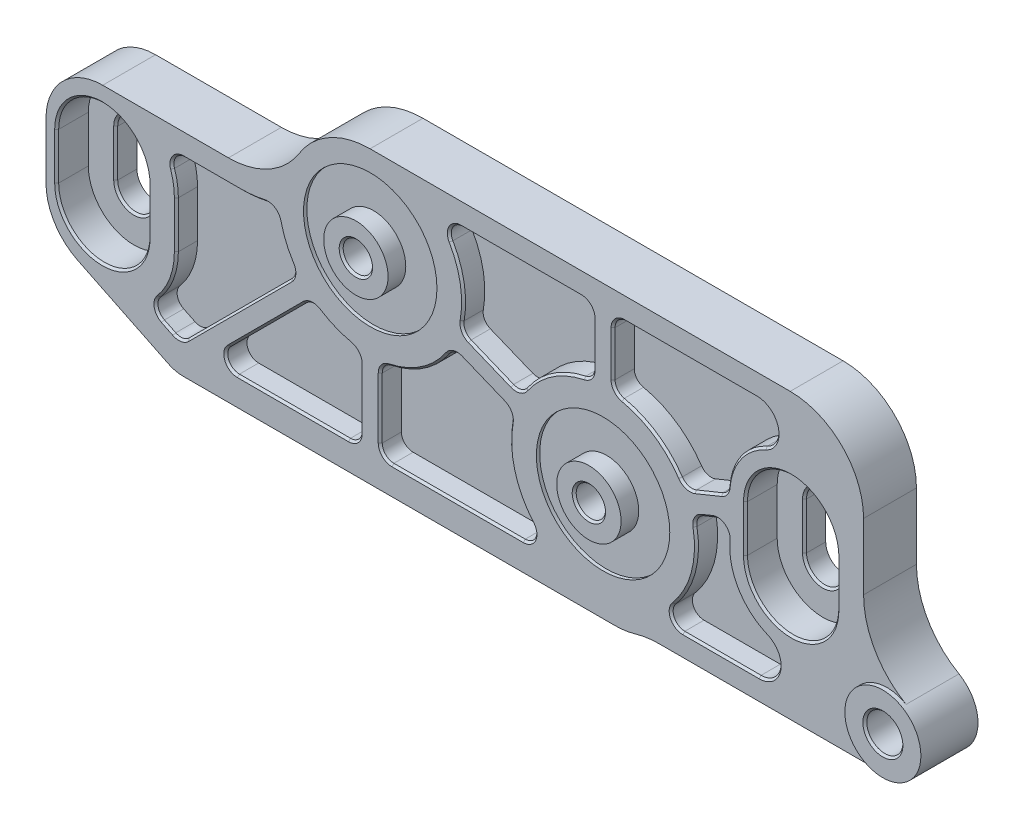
SolidWorks part; units mm, degrees
ref_plane "Front Plane" through (0, 0, 0) normal (0, 0, 1) x (1, 0, 0)
ref_plane "Top Plane" through (0, 0, 0) normal (0, 1, 0) x (1, 0, 0)
ref_plane "Right Plane" through (0, 0, 0) normal (1, 0, 0) x (0, 0, -1)
sketch "Sketch1" plane through (0, 0, 0) normal (0, 0, 1) x (1, 0, 0)
  line L0 (252.15, 1.9) -> (183.8059, 1.9)
  line L7 (0, 46.5) -> (0, 29.5501)
  line L8 (9.5477, 14.2706) -> (36.8355, 0.9615)
  line L9 (41, 0) -> (170.5059, 0)
  line L11 (245.1, 45.2563) -> (245.1, 65.0804)
  line L12 (223.1, 87.0804) -> (97.15, 87.0804)
  line L13 (54.7, 63.5) -> (17, 63.5)
  line L22 (11.4, 45.025) -> (11.4, 31.025)
  line L23 (22.4, 31.025) -> (22.4, 45.025)
  line L26 (217.9, 51.4777) -> (217.9, 37.4777)
  line L27 (228.9, 37.4777) -> (228.9, 51.4777)
  arc A0 (245.1, 45.2563) -> (257.85, 23.1727) centre (270.6, 45.2563) ccw
  arc A1 (252.15, 1.9) -> (257.85, 23.1727) centre (252.15, 13.3) ccw
  arc A2 (183.8059, 1.9) -> (176.6659, 0.88) centre (183.8059, -23.6) ccw
  arc A8 (0, 29.5501) -> (9.5477, 14.2706) centre (17, 29.5501) ccw
  arc A9 (36.8355, 0.9615) -> (41, 0) centre (41, 9.5) ccw
  arc A10 (170.5059, 0) -> (176.6659, 0.88) centre (170.5059, 22) ccw
  arc A12 (245.1, 65.0804) -> (223.1, 87.0804) centre (223.1, 65.0804) ccw
  arc A13 (97.15, 87.0804) -> (75.925, 75.2902) centre (97.15, 62.0804) ccw
  arc A14 (54.7, 63.5) -> (75.925, 75.2902) centre (54.7, 88.5) ccw
  arc A15 (17, 63.5) -> (0, 46.5) centre (17, 46.5) ccw
  arc A28 (11.4, 31.025) -> (22.4, 31.025) centre (16.9, 31.025) ccw
  arc A29 (22.4, 45.025) -> (11.4, 45.025) centre (16.9, 45.025) ccw
  arc A32 (217.9, 37.4777) -> (228.9, 37.4777) centre (223.4, 37.4777) ccw
  arc A33 (228.9, 51.4777) -> (217.9, 51.4777) centre (223.4, 51.4777) ccw
  point P71 (0, 38.025)
  point P77 (11.4, 38.025)
  dimension "D1" = 25.5
  dimension "D2" = 22.8
  dimension "D3" = 25.5
  dimension "D4" = 252.15
  dimension "D5" = 22
  dimension "D6" = 17
  dimension "D7" = 154
  dimension "D8" = 9.5
  dimension "D9" = 63.5
  dimension "D10" = 25
  dimension "D11" = 41
  dimension "D12" = 245.1
  dimension "D13" = 22
  dimension "D14" = 54.7
  dimension "D15" = 97.15
  dimension "D16" = 1.9
  dimension "D17" = 5.5
  dimension "D18" = 14
  dimension "D19" = 16.9
  dimension "D20" = 5.5
  dimension "D21" = 37.4777
  dimension "D22" = 14
  dimension "D23" = 21.7
extrude "Extrude1" add sketch "Sketch1" against normal blind 15.85
sketch "Sketch2" plane through (0, 0, 0) normal (0, 0, 1) x (1, 0, 0)
  circle A2 centre (97.2, 60.9) radius 20
  circle A4 centre (167, 32.4) radius 20
  dimension "D1" = 40
  dimension "D2" = 40
  dimension "D3" = 167
  dimension "D4" = 97.2
  dimension "D5" = 60.9
  dimension "D6" = 32.4
extrude "Cut-Extrude1" cut sketch "Sketch2" against normal blind 1
sketch "Sketch3" plane through (0, 0, -1) normal (0, 0, 1) x (1, 0, 0)
  circle A1 centre (97.2, 60.9) radius 9.65
  circle A3 centre (167.05, 32.3) radius 9.65
  circle A4 centre (97.2, 60.9) radius 20 construction
  dimension "D1" = 19.3
  dimension "D2" = 19.3
  dimension "D3" = 69.85
  dimension "D4" = 28.6
extrude "Extrude2" add sketch "Sketch3" along normal blind 5.3
sketch "Sketch4" plane through (0, 0, 0) normal (0, 0, 1) x (1, 0, 0)
  line L4 (30.6, 30.9) -> (30.6, 44.85)
  line L5 (3.2, 44.85) -> (3.2, 30.9)
  line L11 (209.7, 51.45) -> (209.7, 37.5)
  line L12 (237.1, 37.5) -> (237.1, 51.45)
  arc A4 (3.2, 30.9) -> (30.6, 30.9) centre (16.9, 30.9) ccw
  arc A5 (30.6, 44.85) -> (3.2, 44.85) centre (16.9, 44.85) ccw
  arc A10 (209.7, 37.5) -> (237.1, 37.5) centre (223.4, 37.5) ccw
  arc A11 (237.1, 51.45) -> (209.7, 51.45) centre (223.4, 51.45) ccw
  dimension "D1" = 13.7
  dimension "D2" = 13.7
  dimension "D3" = 223.4
  dimension "D4" = 16.9
  dimension "D5" = 51.45
  dimension "D6" = 30.9
  dimension "D7" = 6.6
  dimension "D8" = 7.35
extrude "Cut-Extrude2" cut sketch "Sketch4" against normal blind 9.5
sketch "Sketch14" plane through (0, 0, 0) normal (0, 0, 1) x (1, 0, 0)
  circle A0 centre (252.15, 13.3) radius 11.4
  arc A1 (252.15, 1.9) -> (257.85, 23.1727) centre (252.15, 13.3) ccw construction
extrude "Extrude4" add sketch "Sketch14" along normal blind 1.27
hole_wizard "M12x1.25 Tapped Hole1" positions "Sketch8" profile "Sketch9" tap size "M12x1.25" standard "ISO"
sketch "Sketch8" plane through (-1.6354, 0.9401, 1.27) normal (0, 0, 1) x (1, 0, 0)
  circle A0 centre (253.7854, 12.3599) radius 11.4 construction
  point P0 (253.7854, 12.3599)
sketch "Sketch9" plane through (252.15, 13.3, 1.27) normal (1, 0, 0) x (0, -1, 0)
  line L0 (0, 0) -> (0, 17.12)
  line L1 (0, 17.12) -> (5.4, 17.12)
  line L2 (5.4, 17.12) -> (5.4, 0)
  line L5 (5.4, 0) -> (0, 0)
  line L11 (0, -6.35) -> (0, 107.95) construction
  dimension "Thru Tap Drill Dia." = 10.8
  dimension "Thru Tap Drill Depth" = 17.12
hole_wizard "M10x1.25 Tapped Hole1" positions "Sketch12" profile "Sketch13" tap size "M10x1.25" standard "ISO"
sketch "Sketch12" plane through (0, 0, 4.3) normal (0, 0, 1) x (1, 0, 0)
  point P0 (97.2, 60.9)
  point P1 (167.05, 32.3)
sketch "Sketch13" plane through (97.2, 60.9, 4.3) normal (1, 0, 0) x (0, -1, 0)
  line L0 (0, 0) -> (0, 20.15)
  line L1 (0, 20.15) -> (4.4, 20.15)
  line L2 (4.4, 20.15) -> (4.4, 0)
  line L5 (4.4, 0) -> (0, 0)
  line L11 (0, -6.35) -> (0, 107.95) construction
  dimension "Thru Tap Drill Dia." = 8.8
  dimension "Thru Tap Drill Depth" = 20.15
sketch "Sketch5" plane through (0, 0, 0) normal (0, 0, 1) x (1, 0, 0)
  line L0 (167, 32.4) -> (97.2, 60.9) construction
  line L1 (167, 32.4) -> (167, 93.8498) construction
  line L2 (97.2, 60.9) -> (97.2, 5.1118) construction
  line L3 (41, 0) -> (170.5059, 0) construction
  line L4 (9.5477, 14.2706) -> (36.8355, 0.9615) construction
  line L5 (97.2, 60.9) -> (46.0418, 9.7418) construction
  line L6 (167, 32.4) -> (236.8, 60.9) construction
  line L7 (223.1, 87.0804) -> (97.15, 87.0804) construction
  line L8 (58.3491, 56.7) -> (41.2491, 56.7)
  line L9 (39.0848, 45.025) -> (39.0848, 31.025)
  line L10 (34.9295, 11.2369) -> (38.3081, 9.589)
  line L11 (42.3173, 10.26) -> (73.2842, 41.2268)
  line L12 (54.7, 63.5) -> (17, 63.5) construction
  line L14 (57.3924, 8.4) -> (90.7, 8.4)
  line L15 (94.2, 11.9) -> (94.2, 30.0779)
  line L16 (77.5268, 36.9842) -> (54.9175, 14.3749)
  line L20 (103.7, 8.4) -> (143.0835, 8.4)
  line L21 (137.3309, 41.2737) -> (124.601, 46.4715)
  line L22 (100.2, 30.0779) -> (100.2, 11.9)
  line L26 (164, 63.2221) -> (164, 76.7804)
  line L27 (160.5, 80.2804) -> (124.4041, 80.2804)
  line L28 (126.8691, 52.0263) -> (139.599, 46.8285)
  line L30 (213.1512, 80.2804) -> (173.5, 80.2804)
  line L31 (170, 76.7804) -> (170, 63.2221)
  line L33 (196.6691, 41.2737) -> (200.1032, 42.6759)
  line L35 (194.401, 46.8285) -> (202.2964, 50.0523)
  line L43 (190.9165, 8.4) -> (213.7865, 8.4)
  arc A0 (216.0937, 19.9386) -> (213.7865, 8.4) centre (213.7865, 14.4) cw
  arc A1 (190.1804, 48.1056) -> (172.7778, 59.7974) centre (167, 32.4) ccw
  arc A2 (200.1032, 42.6759) -> (204.4966, 39.3911) centre (201.3129, 39.7134) cw
  arc A3 (215.6109, 68.8077) -> (213.1512, 80.2804) centre (213.1512, 74.2804) ccw
  arc A4 (194.401, 46.8285) -> (190.1804, 48.1056) centre (193.078, 50.0688) cw
  circle A5 centre (167, 32.4) radius 20 construction
  circle A6 centre (97.2, 60.9) radius 4.4 construction
  arc A7 (228.9, 51.4777) -> (217.9, 51.4777) centre (223.4, 51.4777) ccw construction
  arc A9 (11.4, 31.025) -> (22.4, 31.025) centre (16.9, 31.025) ccw construction
  arc A10 (22.4, 45.025) -> (11.4, 45.025) centre (16.9, 45.025) ccw construction
  arc A11 (204.4966, 39.3911) -> (216.0937, 19.9386) centre (223.4, 37.4777) ccw
  arc A18 (69.8645, 54.836) -> (65.6975, 57.4966) centre (66.4476, 54.078) ccw
  arc A19 (58.3491, 56.7) -> (65.6975, 57.4966) centre (58.3491, 90.99) ccw
  arc A20 (41.2491, 56.7) -> (37.9311, 52.086) centre (41.2491, 53.2) ccw
  arc A21 (39.0848, 45.025) -> (37.9311, 52.086) centre (16.9, 45.025) ccw
  arc A22 (33.7979, 16.6505) -> (39.0848, 31.025) centre (16.9, 31.025) ccw
  arc A23 (33.7979, 16.6505) -> (34.9295, 11.2369) centre (36.4638, 14.3827) ccw
  arc A24 (38.3081, 9.589) -> (42.3173, 10.26) centre (39.8424, 12.7348) ccw
  arc A25 (73.2842, 41.2268) -> (73.7416, 45.6126) centre (70.8093, 43.7017) ccw
  arc A26 (69.8645, 54.836) -> (73.7416, 45.6126) centre (97.2, 60.9) ccw
  arc A28 (90.7, 8.4) -> (94.2, 11.9) centre (90.7, 11.9) ccw
  arc A29 (94.2, 30.0779) -> (91.4222, 33.5026) centre (90.7, 30.0779) ccw
  arc A30 (81.9126, 37.4416) -> (91.4222, 33.5026) centre (97.2, 60.9) ccw
  arc A31 (81.9126, 37.4416) -> (77.5268, 36.9842) centre (80.0017, 34.5093) ccw
  arc A32 (54.9175, 14.3749) -> (57.3924, 8.4) centre (57.3924, 11.9) ccw
  arc A42 (143.0835, 8.4) -> (145.7409, 14.1778) centre (143.0835, 11.9) ccw
  arc A43 (204.4619, 53.0103) -> (202.2964, 50.0523) centre (200.9733, 53.2926) cw
  arc A44 (139.4514, 37.4075) -> (137.3309, 41.2737) centre (136.0078, 38.0334) ccw
  arc A45 (124.601, 46.4715) -> (120.3804, 45.1944) centre (123.278, 43.2312) ccw
  arc A46 (102.9778, 33.5026) -> (120.3804, 45.1944) centre (97.2, 60.9) ccw
  arc A47 (102.9778, 33.5026) -> (100.2, 30.0779) centre (103.7, 30.0779) ccw
  arc A48 (100.2, 11.9) -> (103.7, 8.4) centre (103.7, 11.9) ccw
  arc A56 (164, 76.7804) -> (160.5, 80.2804) centre (160.5, 76.7804) ccw
  arc A57 (124.4041, 80.2804) -> (121.3814, 75.0159) centre (124.4041, 76.7804) ccw
  arc A58 (124.7486, 55.8925) -> (121.3814, 75.0159) centre (97.2, 60.9) ccw
  arc A59 (124.7486, 55.8925) -> (126.8691, 52.0263) centre (128.1922, 55.2666) ccw
  arc A60 (139.599, 46.8285) -> (143.8196, 48.1056) centre (140.922, 50.0688) ccw
  arc A61 (161.2222, 59.7974) -> (143.8196, 48.1056) centre (167, 32.4) ccw
  arc A62 (161.2222, 59.7974) -> (164, 63.2221) centre (160.5, 63.2221) ccw
  arc A64 (215.6109, 68.8077) -> (204.4619, 53.0103) centre (223.4, 51.4777) ccw
  arc A76 (196.6691, 41.2737) -> (194.5486, 37.4075) centre (197.9922, 38.0334) ccw
  arc A77 (188.2591, 14.1778) -> (194.5486, 37.4075) centre (167, 32.4) ccw
  arc A78 (190.9165, 8.4) -> (188.2591, 14.1778) centre (190.9165, 11.9) cw
  arc A80 (173.5, 80.2804) -> (170, 76.7804) centre (173.5, 76.7804) ccw
  arc A81 (170, 63.2221) -> (172.7778, 59.7974) centre (173.5, 63.2221) ccw
  arc A87 (139.4514, 37.4075) -> (145.7409, 14.1778) centre (167, 32.4) ccw
  point P114 (167.9667, 30.0341)
  point P115 (237.8167, 58.6091)
  point P116 (166.0433, 34.7359)
  point P117 (235.8933, 63.3109)
  dimension "D6" = 28
  dimension "D13" = 45
  dimension "D15" = 6.8
  dimension "D7" = 8.4
  dimension "D9" = 6
  dimension "D2" = 19
  dimension "D4" = 3.2
  dimension "D5" = 6.8
  dimension "D3" = 3.5
  dimension "D10" = 6
  dimension "D8" = 8.4
extrude "LW Pockets " cut sketch "Sketch5" against normal blind 6.35
chamfer "Chamfer3" distance 0.6 angle 45 78 edges at (202.3515, 8.4, 0) (187.7367, 10.4375, 0) (194.0269, 25.0825, 0) (194.9234, 39.7166, 0) (198.3862, 41.9748, 0) (192.0643, 46.7188, 0) (198.3487, 48.4404, 0) (182.6147, 55.6418, 0) (203.7974, 51.2251, 0) (170.7817, 61.0173, 0) (207.8766, 62.4333, 0) (170, 70.0012, 0) (171.0251, 79.2552, 0) (193.3256, 80.2804, 0) (133.234, 49.4274, 0) (141.9357, 46.7188, 0) (125.1234, 53.5834, 0) (151.3853, 55.6418, 0) (124.7758, 65.7554, 0) (163.2183, 61.0173, 0) (121.3689, 78.5231, 0) (164, 70.0012, 0) (142.4521, 80.2804, 0) (162.9749, 79.2552, 0) (123.3917, 8.4, 0) (146.2633, 10.4375, 0) (101.2251, 9.4251, 0) (139.9731, 25.0825, 0) (100.2, 20.989, 0) (139.0766, 39.7166, 0) (100.9817, 32.2827, 0) (130.966, 43.8726, 0) (112.8147, 37.6582, 0) (122.2643, 46.5812, 0) (93.1749, 9.4251, 0) (94.2, 20.989, 0) (74.0462, 8.4, 0) (93.4183, 32.2827, 0) (54.1588, 10.5606, 0) (86.4849, 35.0314, 0) (66.2222, 25.6795, 0) (79.6386, 37.9904, 0) (33.0378, 13.6666, 0) (37.7212, 23.3671, 0) (36.6188, 10.413, 0) (39.0848, 38.025, 0) (40.4201, 9.2828, 0) (38.7945, 48.6023, 0) (57.8007, 25.7434, 0) (38.4076, 55.2434, 0) (74.2904, 43.3386, 0) (49.7991, 56.7, 0) (71.3878, 50.0497, 0) (62.0449, 56.8997, 0) (68.3312, 57.0279, 0) (219.0178, 75.5382, 0) (219.67, 13.2235, 0) (223.4, 65.15, 0) (209.7, 44.475, 0) (237.1, 44.475, 0) (223.4, 23.8, 0) (223.4, 56.9777, -9.5) (228.9, 44.4777, -9.5) (217.9, 44.4777, -9.5) (223.4, 31.9777, -9.5) (257.55, 13.3, 1.27) (171.45, 32.3, 4.3) (101.6, 60.9, 4.3) (16.9, 58.55, 0) (3.2, 37.875, 0) (30.6, 37.875, 0) (16.9, 17.2, 0) (16.9, 50.525, -9.5) (22.4, 38.025, -9.5) (11.4, 38.025, -9.5) (16.9, 25.525, -9.5) (207.0802, 27.7482, 0) (203.229, 42.2762, 0)
sketch "Profile" plane through (0, 0, -15.85) normal (0, 0, 1) x (1, 0, 0)
  line L0 (183.8059, 1.9) -> (252.15, 1.9) construction
  line L1 (41, 0) -> (170.5059, 0) construction
  line L2 (9.5477, 14.2706) -> (36.8355, 0.9615) construction
  line L3 (0, 46.5) -> (0, 29.5501) construction
  line L4 (54.7, 63.5) -> (17, 63.5) construction
  line L5 (223.1, 87.0804) -> (97.15, 87.0804) construction
  line L6 (245.1, 45.2563) -> (245.1, 65.0804) construction
  line L7 (183.8059, 1.9) -> (252.15, 1.9)
  line L8 (41, 0) -> (170.5059, 0)
  line L9 (9.5477, 14.2706) -> (36.8355, 0.9615)
  line L10 (0, 46.5) -> (0, 29.5501)
  line L11 (54.7, 63.5) -> (17, 63.5)
  line L12 (223.1, 87.0804) -> (97.15, 87.0804)
  line L13 (245.1, 45.2563) -> (245.1, 65.0804)
  arc A0 (183.8059, 1.9) -> (176.6659, 0.88) centre (183.8059, -23.6) ccw construction
  arc A1 (170.5059, 0) -> (176.6659, 0.88) centre (170.5059, 22) ccw construction
  arc A2 (36.8355, 0.9615) -> (41, 0) centre (41, 9.5) ccw construction
  arc A3 (0, 29.5501) -> (9.5477, 14.2706) centre (17, 29.5501) ccw construction
  arc A4 (17, 63.5) -> (0, 46.5) centre (17, 46.5) ccw construction
  arc A5 (54.7, 63.5) -> (75.925, 75.2902) centre (54.7, 88.5) ccw construction
  arc A6 (97.15, 87.0804) -> (75.925, 75.2902) centre (97.15, 62.0804) ccw construction
  arc A7 (245.1, 65.0804) -> (223.1, 87.0804) centre (223.1, 65.0804) ccw construction
  arc A8 (245.1, 45.2563) -> (257.85, 23.1727) centre (270.6, 45.2563) ccw construction
  arc A9 (252.15, 1.9) -> (257.85, 23.1727) centre (252.15, 13.3) ccw construction
  arc A10 (183.8059, 1.9) -> (176.6659, 0.88) centre (183.8059, -23.6) ccw
  arc A11 (170.5059, 0) -> (176.6659, 0.88) centre (170.5059, 22) ccw
  arc A12 (36.8355, 0.9615) -> (41, 0) centre (41, 9.5) ccw
  arc A13 (0, 29.5501) -> (9.5477, 14.2706) centre (17, 29.5501) ccw
  arc A14 (17, 63.5) -> (0, 46.5) centre (17, 46.5) ccw
  arc A15 (54.7, 63.5) -> (75.925, 75.2902) centre (54.7, 88.5) ccw
  arc A16 (97.15, 87.0804) -> (75.925, 75.2902) centre (97.15, 62.0804) ccw
  arc A17 (245.1, 65.0804) -> (223.1, 87.0804) centre (223.1, 65.0804) ccw
  arc A18 (245.1, 45.2563) -> (257.85, 23.1727) centre (270.6, 45.2563) ccw
  arc A19 (252.15, 1.9) -> (257.85, 23.1727) centre (252.15, 13.3) ccw
